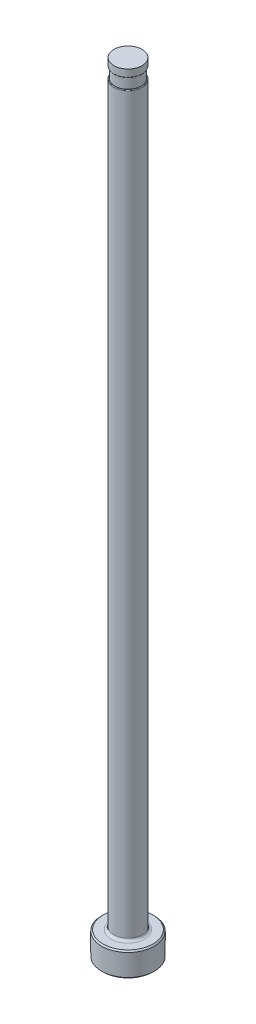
SolidWorks part; units mm, degrees
ref_plane "Front Plane" through (0, 0, 0) normal (0, 0, 1) x (1, 0, 0)
ref_plane "Top Plane" through (0, 0, 0) normal (0, 1, 0) x (1, 0, 0)
ref_plane "Right Plane" through (0, 0, 0) normal (1, 0, 0) x (0, 0, -1)
other "Configuration Table"
sketch "Sketch1" plane through (0, 0, 0) normal (0, 0, 1) x (1, 0, 0)
  line L0 (0, 259.9588) -> (0, -15.1925) construction
  line L1 (0, 0) -> (-5.1562, 0)
  line L2 (-5.1562, 0) -> (-5.1562, 4.7498)
  line L3 (-5.1562, 4.7498) -> (-2.7775, 4.7498)
  line L4 (-2.7775, 4.7498) -> (-2.7775, 152.4)
  line L5 (-2.7775, 152.4) -> (0, 152.4)
  line L6 (0, 152.4) -> (0, 0)
  dimension "L" = 152.4
  dimension "H" = 10.3124
  dimension "T" = 4.7498
  dimension "D" = 5.555
revolve "Revolve1" add sketch "Sketch1" angle 360 about L0
chamfer "Chamfer1" distance 0.254 angle 45 2 edges at (0, 4.7498, 5.1562) (0, 0, 5.1562)
fillet "Fillet1" radius 0.508 1 edges at (0, 4.7498, 2.7775)
sketch "Sketch2" plane through (0, 0, 0) normal (0, 0, 1) x (1, 0, 0)
  line L0 (-2.7775, 152.4) -> (-2.7775, 5.2578) construction
  line L1 (-2.7775, 150.876) -> (-2.5743, 150.876)
  line L2 (-2.7775, 150.876) -> (-2.7775, 148.844)
  line L3 (-2.7775, 148.844) -> (-2.5743, 148.844)
  line L4 (-2.5743, 150.876) -> (-2.5743, 148.844)
  line L5 (2.7775, 152.4) -> (-2.7775, 152.4) construction
  line L6 (0, 153.4483) -> (0, 147.3282) construction
  dimension "D1" = 2.032
  dimension "N" = 1.524
  dimension "FD" = 0.2032
  dimension "D3" = 5.1486
revolve "Vent Relief" cut sketch "Sketch2" angle 360 about L6
sketch "Sketch3" plane through (0, 0, 0) normal (0, 0, 1) x (1, 0, 0)
  line L0 (-2.5743, 149.86) -> (-2.5743, 86.36)
  line L1 (-2.5743, 150.876) -> (-2.5743, 148.844) construction
  line L2 (-2.7775, 148.844) -> (-2.7775, 5.2578) construction
  line L3 (-2.7775, 85.2424) -> (-2.7775, 149.86)
  line L4 (-2.7775, 149.86) -> (-2.5743, 149.86)
  arc A0 (-2.5743, 86.36) -> (-2.7775, 85.2424) centre (-5.7493, 86.36) cw
  dimension "D1" = 3.175
  dimension "D2" = 63.5
extrude "D-Slot" cut sketch "Sketch3" against normal through all both and the other way through all
sketch "Sketch5" plane through (0, 0, 0) normal (0, 0, 1) x (1, 0, 0)
  line L0 (-2.7775, 150.876) -> (2.7775, 150.876) construction
  line L1 (-2.7775, 152.4) -> (-2.7521, 152.4)
  line L2 (-2.7775, 152.4) -> (-2.7775, 150.876)
  line L3 (-2.7775, 150.876) -> (-2.7521, 150.876)
  line L4 (-2.7521, 152.4) -> (-2.7521, 150.876)
  line L5 (0, 152.6877) -> (0, 150.5771) construction
  dimension "VP" = 0.0254
revolve "Vent Diameter" cut sketch "Sketch5" angle 360 about L5
fillet "Fillet2" radius 0.127 2 edges at (2.7775, 148.844, 0) (0, 150.876, 2.7521)
sketch "Pocket Sketch" plane through (0, 0, 0) normal (0, 0, 1) x (1, 0, 0)
  line L0 (-5.5531, 0) -> (-5.5531, 4.7752)
  line L1 (-5.5531, 4.7752) -> (-3.7379, 4.7752)
  line L2 (-2.9759, 5.5372) -> (-2.9759, 22.225)
  line L3 (-2.9759, 22.225) -> (0, 22.225)
  line L4 (0, 22.225) -> (0, 0)
  line L5 (0, 0) -> (-5.5531, 0)
  line L6 (0, 12.6104) -> (0, -2.4989) construction
  line L7 (-5.1562, 4.4958) -> (-5.1562, 0.254) construction
  line L8 (4.9022, 4.7498) -> (-4.9022, 4.7498) construction
  line L9 (-2.7775, 85.2424) -> (-2.7775, 5.2578) construction
  line L10 (-3.7379, 4.7752) -> (-2.9759, 5.5372)
  point P3 (-2.9759, 4.7752)
  dimension "D1" = 11.1061
  dimension "D2" = 0.3969
  dimension "D3" = 0.0254
  dimension "D4" = 0.1984
  dimension "D5" = 5.9519
  dimension "D6" = 22.225
